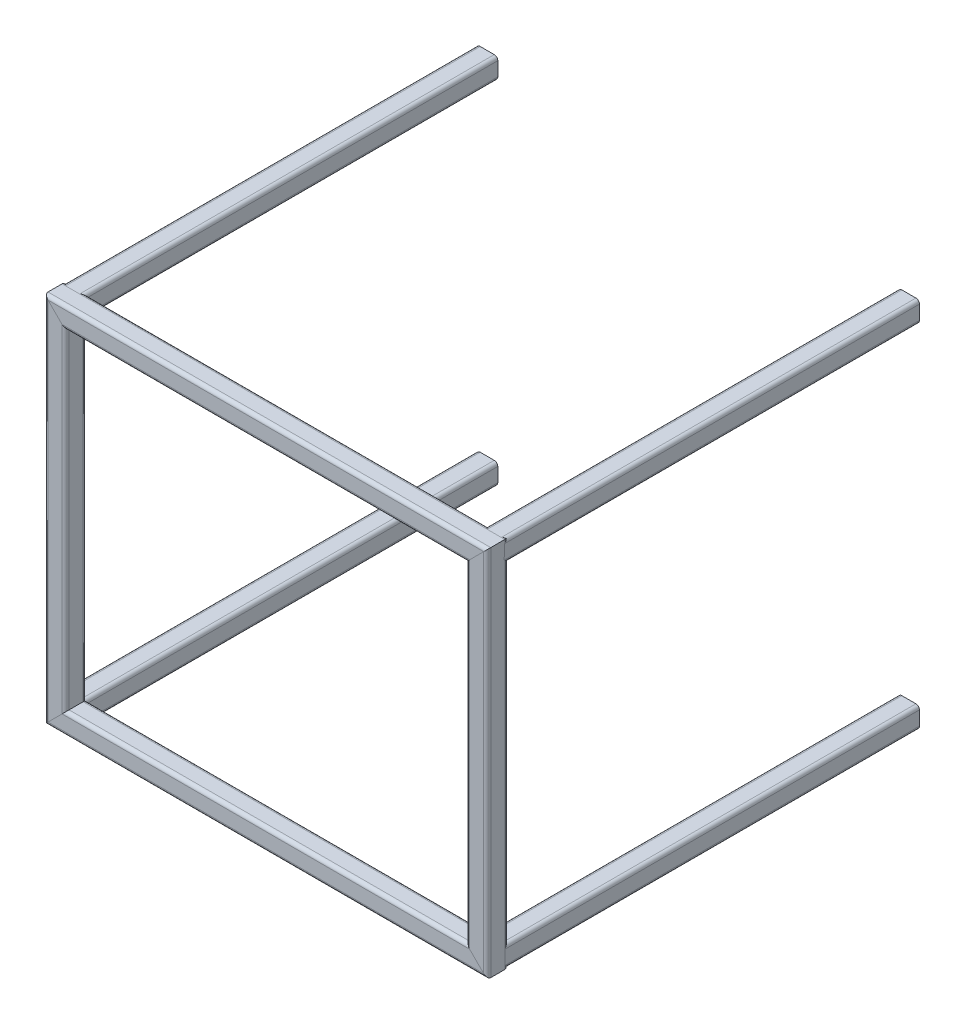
SolidWorks part; units mm, degrees
ref_plane "Front" through (0, 0, 0) normal (0, 0, 1) x (1, 0, 0)
ref_plane "Top" through (0, 0, 0) normal (0, 1, 0) x (1, 0, 0)
ref_plane "Right" through (0, 0, 0) normal (1, 0, 0) x (0, 0, -1)
sketch "Sketch1" plane through (0, 0, 0) normal (0, 0, 1) x (1, 0, 0)
  line L2 (-635, 762) -> (889, 762)
  line L3 (-635, 762) -> (-635, -508)
  line L4 (-635, -508) -> (889, -508)
  line L5 (889, 762) -> (889, -508)
  dimension "D1" = 1524
  dimension "D2" = 1270
  dimension "D3" = 635
  dimension "D4" = 762
ref_plane "Plane1" through (0, -508, 0) normal (0, 1, 0) x (-1, 0, 0)
sketch "Sketch2" plane through (0, -508, 0) normal (0, 1, 0) x (-1, 0, 0)
  line L0 (635, 0) -> (635, -1524)
  line L1 (-889, 0) -> (-889, -1524)
  dimension "D1" = 1524
ref_plane "Plane2" through (0, 762, 0) normal (0, 1, 0) x (-1, 0, 0)
sketch "Sketch3" plane through (0, 762, 0) normal (0, 1, 0) x (-1, 0, 0)
  line L0 (-889, 0) -> (-889, -1524)
  line L1 (635, 0) -> (635, -1524)
  line L2 (-889, 0) -> (-889, -1524) construction
  line L3 (635, 0) -> (635, -1524) construction
ref_plane "Plane3" through (-635, -508, 0) normal (0, 0, -1) x (-1, 0, 0)
other "Structural Member1"
ref_plane "Plane6" through (-635, 762, 0) normal (0, -1, 0) x (1, 0, 0)
sketch "Sketch13" plane through (-635, 762, 0) normal (0, -1, 0) x (1, 0, 0)
  line L0 (-25.4, -31.75) -> (25.4, -31.75)
  line L1 (-31.75, -25.4) -> (-31.75, 25.4)
  line L2 (25.4, 31.75) -> (-25.4, 31.75)
  line L3 (31.75, 25.4) -> (31.75, -25.4)
  line L4 (-25.4, -38.1) -> (25.4, -38.1)
  line L5 (-38.1, -25.4) -> (-38.1, 25.4)
  line L6 (25.4, 38.1) -> (-25.4, 38.1)
  line L7 (38.1, 25.4) -> (38.1, -25.4)
  line L8 (0, 0) -> (38.1, 0) construction
  line L9 (0, 0) -> (0, 38.1) construction
  arc A0 (38.1, 25.4) -> (25.4, 38.1) centre (25.4, 25.4) ccw
  arc A1 (25.4, -38.1) -> (38.1, -25.4) centre (25.4, -25.4) ccw
  arc A2 (-38.1, -25.4) -> (-25.4, -38.1) centre (-25.4, -25.4) ccw
  arc A3 (-25.4, 38.1) -> (-38.1, 25.4) centre (-25.4, 25.4) ccw
  arc A4 (-25.4, 31.75) -> (-31.75, 25.4) centre (-25.4, 25.4) ccw
  arc A5 (31.75, 25.4) -> (25.4, 31.75) centre (25.4, 25.4) ccw
  arc A6 (25.4, -31.75) -> (31.75, -25.4) centre (25.4, -25.4) ccw
  arc A7 (-31.75, -25.4) -> (-25.4, -31.75) centre (-25.4, -25.4) ccw
  point P3 (0, -38.1)
  point P5 (0, 0)
  point P33 (0, 0)
  point P36 (38.1, 0)
  point P37 (0, 38.1)
  dimension "D1" = 12.7
  dimension "Thickness" = 6.35
  dimension "V_leg" = 76.2
  dimension "H_leg" = 76.2
other "Structural Member2"
ref_plane "Plane7" through (-635, -508, 0) normal (0, 0, -1) x (-1, 0, 0)
sketch "Sketch14" plane through (-635, -508, 0) normal (0, 0, -1) x (-1, 0, 0)
  line L0 (-25.4, -31.75) -> (25.4, -31.75)
  line L1 (-31.75, -25.4) -> (-31.75, 25.4)
  line L2 (25.4, 31.75) -> (-25.4, 31.75)
  line L3 (31.75, 25.4) -> (31.75, -25.4)
  line L4 (-25.4, -38.1) -> (25.4, -38.1)
  line L5 (-38.1, -25.4) -> (-38.1, 25.4)
  line L6 (25.4, 38.1) -> (-25.4, 38.1)
  line L7 (38.1, 25.4) -> (38.1, -25.4)
  line L8 (0, 0) -> (38.1, 0) construction
  line L9 (0, 0) -> (0, 38.1) construction
  arc A0 (38.1, 25.4) -> (25.4, 38.1) centre (25.4, 25.4) ccw
  arc A1 (25.4, -38.1) -> (38.1, -25.4) centre (25.4, -25.4) ccw
  arc A2 (-38.1, -25.4) -> (-25.4, -38.1) centre (-25.4, -25.4) ccw
  arc A3 (-25.4, 38.1) -> (-38.1, 25.4) centre (-25.4, 25.4) ccw
  arc A4 (-25.4, 31.75) -> (-31.75, 25.4) centre (-25.4, 25.4) ccw
  arc A5 (31.75, 25.4) -> (25.4, 31.75) centre (25.4, 25.4) ccw
  arc A6 (25.4, -31.75) -> (31.75, -25.4) centre (25.4, -25.4) ccw
  arc A7 (-31.75, -25.4) -> (-25.4, -31.75) centre (-25.4, -25.4) ccw
  point P3 (0, -38.1)
  point P4 (-38.1, 0)
  point P5 (0, 0)
  point P6 (38.1, -38.1)
  point P7 (-38.1, -38.1)
  point P8 (-38.1, 38.1)
  point P33 (0, 0)
  point P35 (38.1, 38.1)
  point P36 (38.1, 0)
  point P37 (0, 38.1)
  dimension "D1" = 12.7
  dimension "Thickness" = 6.35
  dimension "V_leg" = 76.2
  dimension "H_leg" = 76.2
other "Structural Member3"
ref_plane "Plane8" through (-635, 762, 0) normal (0, 0, -1) x (-1, 0, 0)
sketch "Sketch15" plane through (-635, 762, 0) normal (0, 0, -1) x (-1, 0, 0)
  line L0 (-25.4, -31.75) -> (25.4, -31.75)
  line L1 (-31.75, -25.4) -> (-31.75, 25.4)
  line L2 (25.4, 31.75) -> (-25.4, 31.75)
  line L3 (31.75, 25.4) -> (31.75, -25.4)
  line L4 (-25.4, -38.1) -> (25.4, -38.1)
  line L5 (-38.1, -25.4) -> (-38.1, 25.4)
  line L6 (25.4, 38.1) -> (-25.4, 38.1)
  line L7 (38.1, 25.4) -> (38.1, -25.4)
  line L8 (0, 0) -> (38.1, 0) construction
  line L9 (0, 0) -> (0, 38.1) construction
  arc A0 (38.1, 25.4) -> (25.4, 38.1) centre (25.4, 25.4) ccw
  arc A1 (25.4, -38.1) -> (38.1, -25.4) centre (25.4, -25.4) ccw
  arc A2 (-38.1, -25.4) -> (-25.4, -38.1) centre (-25.4, -25.4) ccw
  arc A3 (-25.4, 38.1) -> (-38.1, 25.4) centre (-25.4, 25.4) ccw
  arc A4 (-25.4, 31.75) -> (-31.75, 25.4) centre (-25.4, 25.4) ccw
  arc A5 (31.75, 25.4) -> (25.4, 31.75) centre (25.4, 25.4) ccw
  arc A6 (25.4, -31.75) -> (31.75, -25.4) centre (25.4, -25.4) ccw
  arc A7 (-31.75, -25.4) -> (-25.4, -31.75) centre (-25.4, -25.4) ccw
  point P3 (0, -38.1)
  point P4 (-38.1, 0)
  point P5 (0, 0)
  point P6 (38.1, -38.1)
  point P7 (-38.1, -38.1)
  point P8 (-38.1, 38.1)
  point P33 (0, 0)
  point P35 (38.1, 38.1)
  point P36 (38.1, 0)
  point P37 (0, 38.1)
  dimension "D1" = 12.7
  dimension "Thickness" = 6.35
  dimension "V_leg" = 76.2
  dimension "H_leg" = 76.2
other "Trim/Extend1" [suppressed]
other "Trim/Extend2" [suppressed]
other "Trim/Extend3" [suppressed]
other "Trim/Extend4" [suppressed]
ref_plane "Plane9" through (-106.68, 0, 0) normal (1, 0, 0) x (0, 0, -1)
equation "\"D3@Sketch1\" = \"D2@Sketch1\"/2"
equation "\"D4@Sketch1\" = \"D1@Sketch1\"/2"
